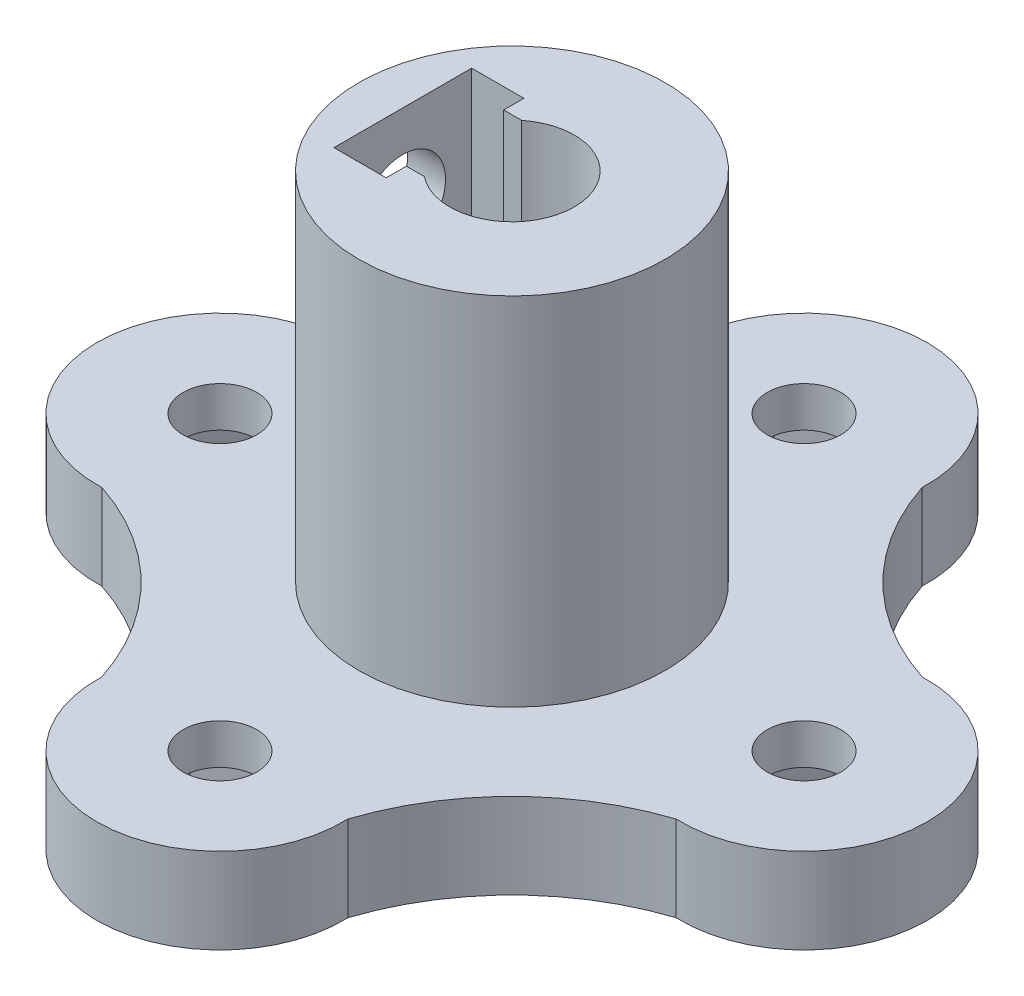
SolidWorks part; units mm, degrees
ref_plane "Front Plane" through (0, 0, 0) normal (0, 0, 1) x (1, 0, 0)
ref_plane "Top Plane" through (0, 0, 0) normal (0, 1, 0) x (1, 0, 0)
ref_plane "Right Plane" through (0, 0, 0) normal (1, 0, 0) x (0, 0, -1)
sketch "Sketch1" plane through (0, 0, 0) normal (0, 1, 0) x (1, 0, 0)
  circle A0 centre (0, 0) radius 15.25
  circle A1 centre (0, 0) radius 2.625
  circle A2 centre (0, 12.3) radius 1.55
  circle A3 centre (12.3, 0) radius 1.55
  circle A4 centre (0, -12.3) radius 1.55
  circle A5 centre (-12.3, 0) radius 1.55
  point P15 (0, 0)
extrude "Boss-Extrude1" add sketch "Sketch1" along normal blind 3.6
sketch "Sketch2" plane through (0, 3.6, 0) normal (0, 1, 0) x (1, 0, 0)
  circle A0 centre (0, 0) radius 6.45
  circle A1 centre (0, 0) radius 2.625
  dimension "D1" = 12.9
  dimension "D2" = 5.25
extrude "Boss-Extrude2" add sketch "Sketch2" along normal blind 15
sketch "Sketch4" plane through (0, 18.6, 0) normal (0, 1, 0) x (1, 0, 0)
  line L0 (-4.6, 2.9) -> (-2.4, 2.9)
  line L1 (-4.6, 2.9) -> (-4.6, -2.9)
  line L2 (-4.6, -2.9) -> (-2.4, -2.9)
  line L3 (-2.4, 2.9) -> (-2.4, -2.9)
  line L4 (0, 0) -> (-2.4, 0) construction
  dimension "D1" = 2.2
  dimension "D2" = 5.8
  dimension "D4" = 2.4
extrude "Cut-Extrude4" cut sketch "Sketch4" against normal blind 7
sketch "Sketch5" plane through (0, 3.6, 0) normal (0, 1, 0) x (1, 0, 0)
  circle A0 centre (0, 12.3) radius 5.185
  circle A1 centre (12.3, 0) radius 5.185
  circle A2 centre (0, -12.3) radius 5.185
  circle A3 centre (-12.3, 0) radius 5.185
  circle A4 centre (0, 0) radius 15.25 construction
  circle A5 centre (0, 12.3) radius 1.55
  circle A6 centre (0, 12.3) radius 1.55 construction
  circle A7 centre (12.3, 0) radius 1.55
  circle A8 centre (0, -12.3) radius 1.55
  circle A9 centre (-12.3, 0) radius 1.55
  point P12 (0, 0)
  point P24 (0, 0)
  dimension "D1" = 10.37
  dimension "D2" = 4
  dimension "D3" = 4
extrude "Boss-Extrude3" add sketch "Sketch5" against normal up to surface (3.6 mm away)
sketch "Sketch6" plane through (0, 3.6, 0) normal (0, 1, 0) x (1, 0, 0)
  arc A0 (4.69, 14.5109) -> (14.5109, 4.69) centre (15.4385, 15.4385) ccw
  arc A1 (4.69, 14.5109) -> (-4.69, 14.5109) centre (0, 12.3) ccw construction
  circle A2 centre (0, 0) radius 15.25 construction
  arc A3 (4.69, 14.5109) -> (14.5109, 4.69) centre (0, 0) cw
extrude "Cut-Extrude5" cut sketch "Sketch6" against normal up to next
pattern_circular "CirPattern1" count 4 over 360 about axis through (0, 0, 0) along (0, 1, 0) of "Cut-Extrude5"
sketch "Sketch7" plane through (0, 3.6, 0) normal (0, 1, 0) x (1, 0, 0)
  circle A0 centre (0, -12.3) radius 5.185
  circle A1 centre (0, -12.3) radius 1.55
  arc A2 (-4.69, -14.5109) -> (4.69, -14.5109) centre (0, -12.3) ccw construction
  circle A3 centre (0, -12.3) radius 1.55 construction
  circle A4 centre (-12.3, 0) radius 5.185
  circle A5 centre (-12.3, 0) radius 1.55
  circle A6 centre (0, 12.3) radius 5.185
  circle A7 centre (0, 12.3) radius 1.55
  circle A8 centre (12.3, 0) radius 5.185
  circle A9 centre (12.3, 0) radius 1.55
  circle A10 centre (0, 0) radius 6.45 construction
  point P24 (0, 0)
  dimension "D1" = 4
extrude "Boss-Extrude4" add sketch "Sketch7" against normal up to surface (3.6 mm away)
sketch "Sketch8" plane through (0, 0, 0) normal (0, -1, 0) x (1, 0, 0)
  line L0 (0, 0) -> (0, -8.8359) construction
  line L1 (0, -8.8359) -> (-3, -10.5679)
  line L2 (-3, -10.5679) -> (-3, -14.0321)
  line L3 (-3, -14.0321) -> (0, -15.7641)
  line L4 (0, -15.7641) -> (3, -14.0321)
  line L5 (3, -14.0321) -> (3, -10.5679)
  line L6 (3, -10.5679) -> (0, -8.8359)
  line L7 (-8.8359, 0) -> (-10.5679, 3)
  line L8 (-10.5679, 3) -> (-14.0321, 3)
  line L9 (-14.0321, 3) -> (-15.7641, 0)
  line L10 (-15.7641, 0) -> (-14.0321, -3)
  line L11 (-14.0321, -3) -> (-10.5679, -3)
  line L12 (-10.5679, -3) -> (-8.8359, 0)
  line L13 (0, 8.8359) -> (3, 10.5679)
  line L14 (3, 10.5679) -> (3, 14.0321)
  line L15 (3, 14.0321) -> (0, 15.7641)
  line L16 (0, 15.7641) -> (-3, 14.0321)
  line L17 (-3, 14.0321) -> (-3, 10.5679)
  line L18 (-3, 10.5679) -> (0, 8.8359)
  line L19 (8.8359, 0) -> (10.5679, -3)
  line L20 (10.5679, -3) -> (14.0321, -3)
  line L21 (14.0321, -3) -> (15.7641, 0)
  line L22 (15.7641, 0) -> (14.0321, 3)
  line L23 (14.0321, 3) -> (10.5679, 3)
  line L24 (10.5679, 3) -> (8.8359, 0)
  circle A0 centre (0, -12.3) radius 3 construction
  circle A1 centre (0, -12.3) radius 1.55 construction
  circle A2 centre (-12.3, 0) radius 3 construction
  circle A3 centre (0, 12.3) radius 3 construction
  circle A4 centre (12.3, 0) radius 3 construction
  circle A5 centre (0, 0) radius 2.625 construction
  point P39 (0, 0)
  dimension "D1" = 6
  dimension "D2" = 4
extrude "Cut-Extrude6" cut sketch "Sketch8" against normal blind 1.9
sketch "Sketch9" plane through (0, 18.6, 0) normal (0, 1, 0) x (1, 0, 0)
  line L0 (-4.6, 2.9) -> (-4.6, -2.9) construction
  line L1 (-4.6, 2.05) -> (0, 2.05)
  line L2 (-4.6, 2.05) -> (-4.6, -2.05)
  line L3 (-4.6, -2.05) -> (0, -2.05)
  line L4 (0, 2.05) -> (0, -2.05)
  arc A0 (-2.4, -1.0633) -> (-2.4, 1.0633) centre (0, 0) ccw construction
  point P6 (0, 0)
  point P11 (0, 0)
  dimension "D1" = 4.1
extrude "Cut-Extrude7" cut sketch "Sketch9" against normal up to surface (7 mm away)
ref_plane "Plane1" through (-6.45, 0, 0) normal (-1, 0, 0) x (0, 0, 1)
sketch "Sketch10" plane through (-6.45, 0, 0) normal (-1, 0, 0) x (0, 0, 1)
  line L0 (0, 18.6) -> (0, 3.6) construction
  line L1 (6.45, 18.6) -> (-6.45, 18.6) construction
  line L2 (12.0957, 3.6) -> (5.181, 3.6) construction
  point P0 (0, 15.1)
  dimension "D1" = 3.5
hole_wizard "M3 Clearance Hole1" positions "Sketch11" profile "Sketch12" hole size "M3" standard "ANSI Metric"
sketch "Sketch11" plane through (-6.45, 0, 0) normal (-1, 0, 0) x (0, 0, 1)
  point P0 (0, 15.1)
sketch "Sketch12" plane through (-6.45, 15.1, 0) normal (0, 1, 0) x (0, 0, 1)
  line L0 (0, 0) -> (0, 6.0815)
  line L1 (0, 6.0815) -> (1.8, 5)
  line L2 (1.8, 5) -> (1.8, 0)
  line L5 (1.8, 0) -> (0, 0)
  line L10 (0, 6.0815) -> (-1.8, 5) construction
  line L11 (0, -6.35) -> (0, 107.95) construction
  dimension "Hole Dia." = 3.6
  dimension "Hole Depth" = 5
  dimension "Drill Angle" = 118
equation "\"base_diameter\"=30.5"
equation "\"D1@Sketch1\"=\"base_diameter\""
